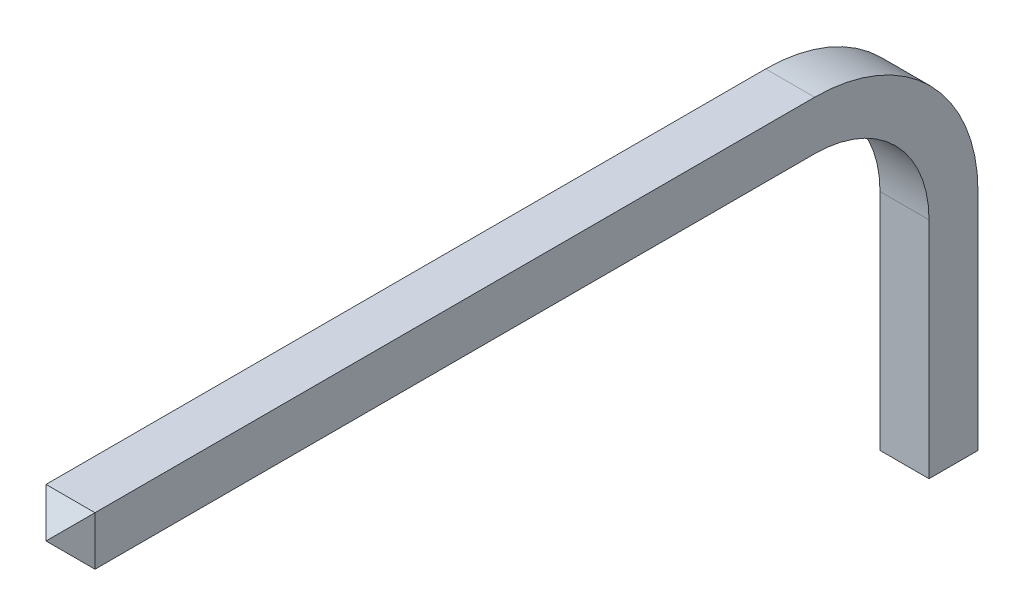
SolidWorks part; units mm, degrees
ref_plane "Front Plane" through (0, 0, 0) normal (0, 0, 1) x (1, 0, 0)
ref_plane "Top Plane" through (0, 0, 0) normal (0, 1, 0) x (1, 0, 0)
ref_plane "Right Plane" through (0, 0, 0) normal (1, 0, 0) x (0, 0, -1)
sketch "Sketch1" plane through (0, 0, 0) normal (1, 0, 0) x (0, 0, -1)
  line L0 (0, 0) -> (0, 5.2324)
  line L1 (-3.81, 9.0424) -> (-20.5994, 9.0424)
  arc A0 (0, 5.2324) -> (-3.81, 9.0424) centre (-3.81, 5.2324) ccw
  point P6 (0, 9.0424)
  dimension "D3" = 3.81
  dimension "D1" = 9.0424
  dimension "D2" = 20.5994
extrude "Extrude-Thin1" add sketch "Sketch1" along normal mid plane 1.143 thin
sketch "Sketch2" plane through (0, 0, 20.5994) normal (0, 0, 1) x (1, 0, 0)
  line L4 (-0.5715, 9.0424) -> (-0.5715, 7.8994)
  line L5 (-0.5715, 7.8994) -> (0.5715, 7.8994)
  line L6 (0.5715, 7.8994) -> (0.5715, 9.0424)
  line L7 (0.5715, 9.0424) -> (-0.5715, 9.0424)
  line L8 (-0.5715, 9.0424) -> (-0.5715, 7.8994)
  line L9 (-0.5715, 7.8994) -> (0.5715, 7.8994)
  line L10 (0.5715, 7.8994) -> (0.5715, 9.0424)
  line L11 (0.5715, 9.0424) -> (-0.5715, 9.0424)
  dimension "D1" = 0
extrude "Boss-Extrude1" add sketch "Sketch2" along normal blind 1.1176 draft 45
sketch "Sketch3" plane through (0, 0, 0) normal (0, -1, 0) x (1, 0, 0)
  line L4 (-0.5715, 1.143) -> (-0.5715, 0)
  line L5 (-0.5715, 0) -> (0.5715, 0)
  line L6 (0.5715, 0) -> (0.5715, 1.143)
  line L7 (0.5715, 1.143) -> (-0.5715, 1.143)
  line L8 (-0.5715, 1.143) -> (-0.5715, 0)
  line L9 (-0.5715, 0) -> (0.5715, 0)
  line L10 (0.5715, 0) -> (0.5715, 1.143)
  line L11 (0.5715, 1.143) -> (-0.5715, 1.143)
  dimension "D1" = 0
extrude "Boss-Extrude2" add sketch "Sketch3" along normal blind 1.1176 draft 45
